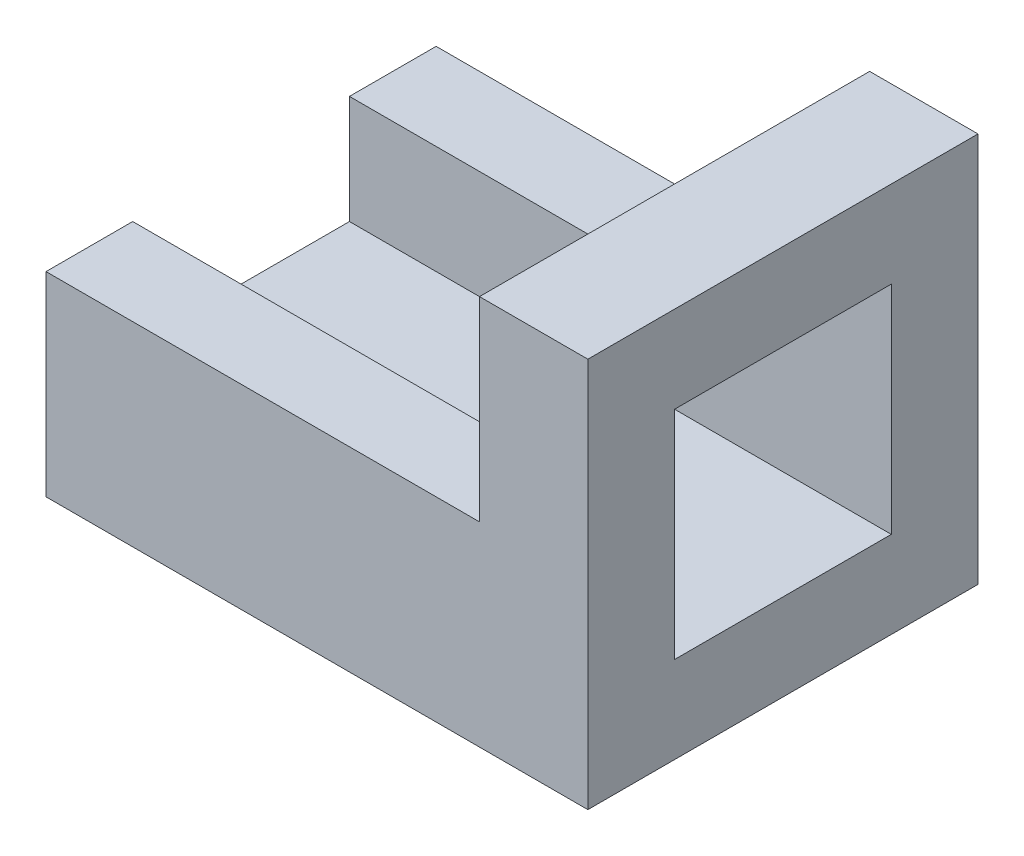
SolidWorks part; units mm, degrees
ref_plane "前视基准面" through (0, 0, 0) normal (0, 0, 1) x (1, 0, 0)
ref_plane "上视基准面" through (0, 0, 0) normal (0, 1, 0) x (1, 0, 0)
ref_plane "右视基准面" through (0, 0, 0) normal (1, 0, 0) x (0, 0, -1)
sketch "草图1" plane through (0, 0, 0) normal (0, 0, 1) x (1, 0, 0)
  line L0 (80, 72) -> (80, 36)
  line L1 (0, 0) -> (100, 0)
  line L2 (0, 0) -> (0, 36)
  line L3 (80, 72) -> (100, 72)
  line L4 (100, 0) -> (100, 72)
  line L5 (80, 36) -> (0, 36)
  dimension "D1" = 100
  dimension "D2" = 72
extrude "拉伸1" add sketch "草图1" along normal mid plane 72
sketch "草图2" plane through (100, 0, 0) normal (1, 0, 0) x (0, 0, -1)
  line L0 (-36, 0) -> (36, 0) construction
  line L1 (-20, 56) -> (20, 56)
  line L2 (-20, 56) -> (-20, 16)
  line L3 (-20, 16) -> (20, 16)
  line L4 (20, 56) -> (20, 16)
  line L5 (36, 0) -> (36, 72) construction
  dimension "D1" = 40
  dimension "D2" = 40
  dimension "D3" = 16
  dimension "D4" = 16
extrude "切除-拉伸1" cut sketch "草图2" against normal through all
